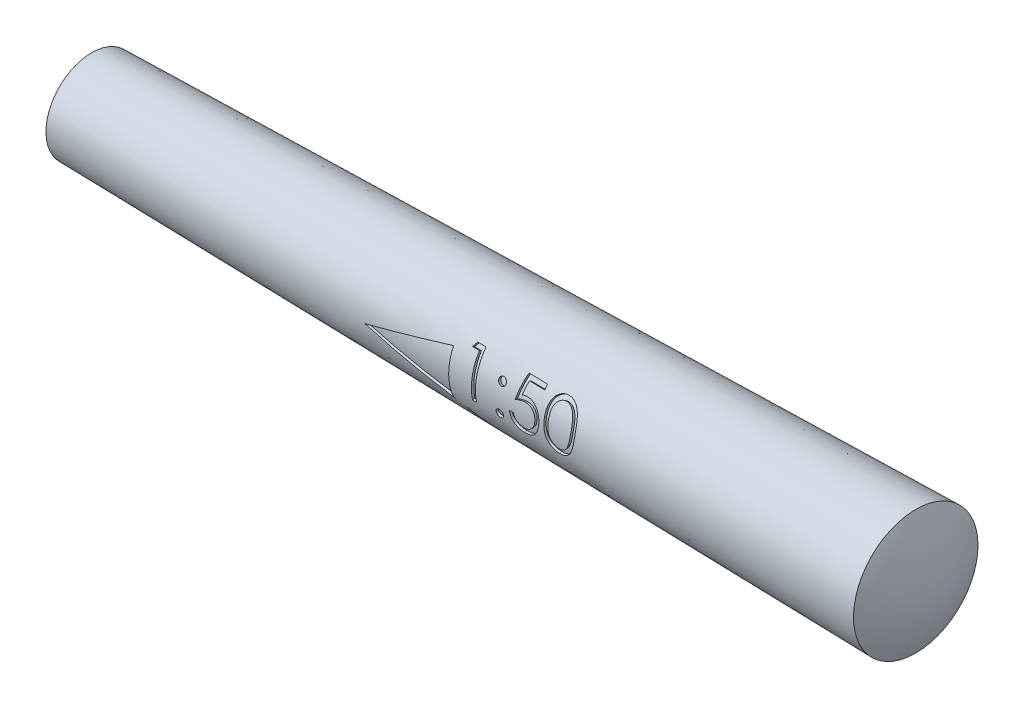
SolidWorks part; units mm, degrees
ref_plane "Front Plane" through (0, 0, 0) normal (0, 0, 1) x (1, 0, 0)
ref_plane "Top Plane" through (0, 0, 0) normal (0, 1, 0) x (1, 0, 0)
ref_plane "Right Plane" through (0, 0, 0) normal (1, 0, 0) x (0, 0, -1)
sketch "Sketch1" plane through (0, 0, 0) normal (1, 0, 0) x (0, 0, -1)
  circle A0 centre (0, 0) radius 1
  dimension "D1" = 2
extrude "Extrude1" add sketch "Sketch1" along normal mid plane 18
draft "Draft1" type of draft neutral plane draft angle 1.146 faces to draft 1 parameters "D1"=1.146
sketch "Sketch2" plane through (0, 0, 0) normal (0, 0, 1) x (1, 0, 0)
  line L0 (-9, 0) -> (-9, 1)
  line L1 (-9, 1) -> (-9, -1) construction
  line L2 (-9, 0) -> (-9.3, 0)
  line L3 (-9.3, 0) -> (-9.3, -1.18) construction
  line L4 (9, 0) -> (9, 1.36)
  line L5 (9, -1.36) -> (9, 1.36) construction
  line L6 (9, 0) -> (9.3, 0)
  line L7 (9.3, 0) -> (9.3, -1.18) construction
  line L8 (-9, -1) -> (9, -1.36) construction
  arc A0 (-9.3, 0) -> (-9, 1) centre (-7.4833, 0) cw
  arc A1 (9.3, 0) -> (9, 1.36) centre (6.0673, 0) ccw
  point P14 (0, -1.18)
revolve "Revolve1" add sketch "Sketch2" angle 360 about L2
sketch "Sketch5" plane through (0, 0, 0) normal (0, 0, 1) x (1, 0, 0)
  line L0 (0, 1.18) -> (0, -1.18) construction
  line L1 (9, 1.36) -> (-9, 1) construction
  line L2 (-9, -1) -> (9, -1.36) construction
ref_plane "Plane2" through (0, 0, 0) normal (-0.02, 0, 0.9998) x (0.9998, 0, 0.02)
sketch "Sketch6" plane through (0, 0, 0) normal (-0.02, 0, 0.9998) x (0.9998, 0, 0.02)
  line L0 (0, 0) -> (0, 0.5)
  line L1 (0, 1.18) -> (0, -1.18) construction
  line L2 (0, 0.5) -> (-1.866, 0)
  line L3 (-1.866, 0) -> (0, -0.5)
  line L4 (0, -0.5) -> (0, 0)
  line L5 (0, -0.25) -> (3, -0.25) construction
  text T0 "1:50" font "Century Gothic" height 1
  dimension "D1" = 1
  dimension "D2" = 30
  dimension "D3" = 3
wrap "Wrap2" sketch "Sketch6" wrap type deboss source sketch "Sketch6" thickness 0.05 parameters "D1"=0.05
equation "\"D2@Sketch2\" = \"D1@Sketch2\""
